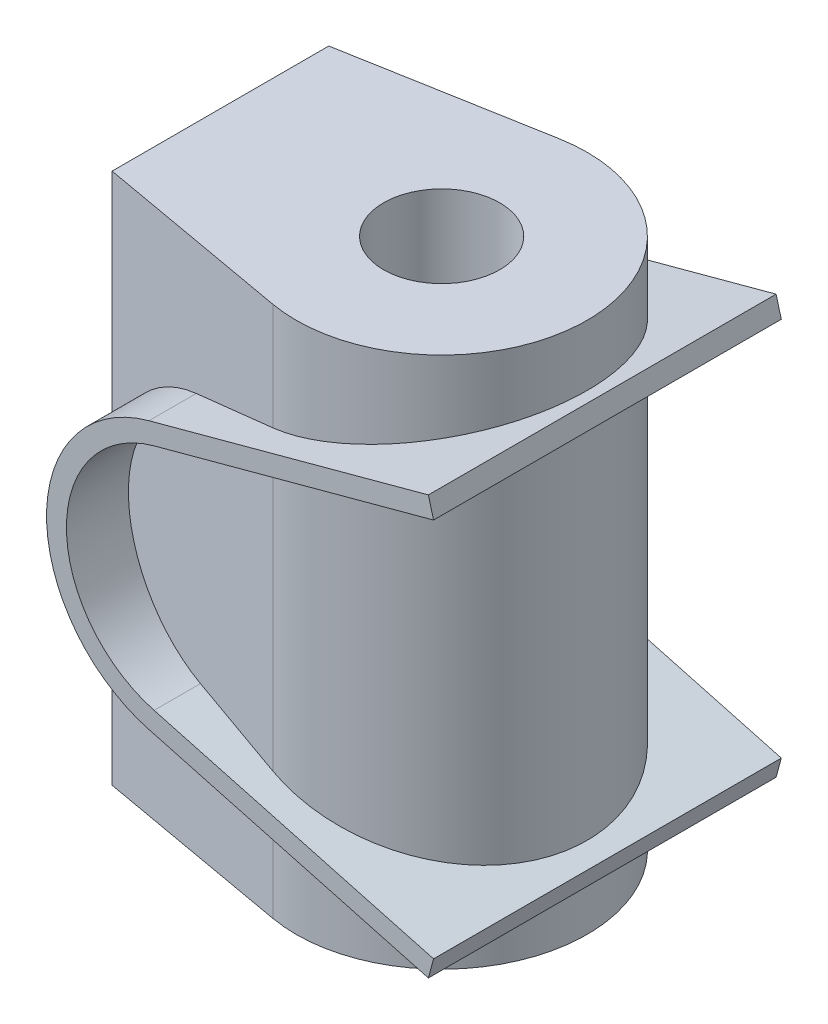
SolidWorks part; units mm, degrees
ref_plane "Front Plane" through (0, 0, 0) normal (0, 0, 1) x (1, 0, 0)
ref_plane "Top Plane" through (0, 0, 0) normal (0, 1, 0) x (1, 0, 0)
ref_plane "Right Plane" through (0, 0, 0) normal (1, 0, 0) x (0, 0, -1)
sketch "Sketch1" plane through (0, 0, 0) normal (0, 0, 1) x (1, 0, 0)
  line L0 (0, 47.4622) -> (0, -68.0659) construction
  line L1 (-3.9543, 14.6396) -> (31.7638, 24.2873)
  line L2 (-3.9543, -14.6396) -> (31.7638, -24.2873)
  line L3 (0, 0) -> (31.7638, 0) construction
  arc A0 (-3.9543, 14.6396) -> (-3.9543, -14.6396) centre (0, 0) ccw
extrude "Extrude-Thin1" add sketch "Sketch1" along normal mid plane 44.45 thin
sketch "Sketch2" plane through (0, 0, 0) normal (0, 1, 0) x (1, 0, 0)
  line L0 (-17.7042, 13.8475) -> (7.3041, 18.3128)
  line L2 (7.3041, -18.3128) -> (-17.7042, -13.8475)
  line L3 (-17.7042, -13.8475) -> (-17.7042, 13.8475)
  line L5 (-17.7042, 0) -> (0, 0) construction
  line L6 (-17.7042, 22.225) -> (-17.7042, -22.225) construction
  arc A0 (7.3041, 18.3128) -> (7.3041, -18.3128) centre (10.5738, 0) cw
  circle A1 centre (10.5738, 0) radius 7.4231
extrude "Extrude1" add sketch "Sketch2" along normal mid plane 67.9891 separate body
